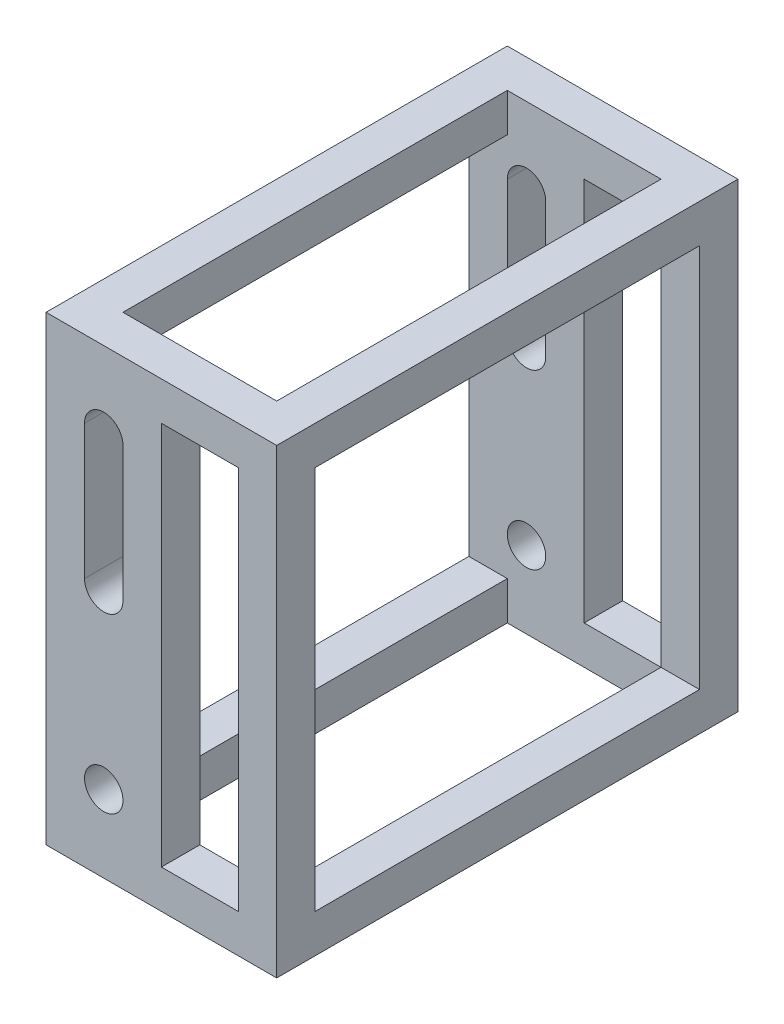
SolidWorks part; units mm, degrees
ref_plane "Front Plane" through (0, 0, 0) normal (0, 0, 1) x (1, 0, 0)
ref_plane "Top Plane" through (0, 0, 0) normal (0, 1, 0) x (1, 0, 0)
ref_plane "Right Plane" through (0, 0, 0) normal (1, 0, 0) x (0, 0, -1)
sketch "Sketch2" plane through (0, 0, 0) normal (0, 0, 1) x (1, 0, 0)
  line L1 (0, 0) -> (76.2, 0)
  line L2 (0, 0) -> (0, 152.4)
  line L3 (0, 152.4) -> (76.2, 152.4)
  line L4 (76.2, 0) -> (76.2, 152.4)
  dimension "D1" = 76.2
  dimension "D2" = 152.4
extrude "Boss-Extrude1" add sketch "Sketch2" along normal blind 152.4
sketch "Sketch3" plane through (0, 152.4, 0) normal (0, 1, 0) x (1, 0, 0)
  line L0 (76.2, 0) -> (0, 0) construction
  line L1 (12.7, -12.7) -> (63.5, -12.7)
  line L2 (12.7, -12.7) -> (12.7, -139.7)
  line L3 (12.7, -139.7) -> (63.5, -139.7)
  line L4 (63.5, -12.7) -> (63.5, -139.7)
  line L5 (76.2, -152.4) -> (76.2, 0) construction
  line L6 (76.2, -152.4) -> (0, -152.4) construction
  line L7 (0, -152.4) -> (0, 0) construction
  dimension "D1" = 12.7
  dimension "D2" = 12.7
  dimension "D3" = 12.7
  dimension "D4" = 12.7
extrude "Cut-Extrude1" cut sketch "Sketch3" against normal through all
sketch "Sketch4" plane through (76.2, 0, 0) normal (1, 0, 0) x (0, 0, -1)
  line L0 (-152.4, 152.4) -> (0, 152.4) construction
  line L1 (-139.7, 139.7) -> (-12.7, 139.7)
  line L2 (-139.7, 139.7) -> (-139.7, 12.7)
  line L3 (-139.7, 12.7) -> (-12.7, 12.7)
  line L4 (-12.7, 139.7) -> (-12.7, 12.7)
  line L5 (0, 0) -> (0, 152.4) construction
  line L6 (-152.4, 0) -> (0, 0) construction
  line L7 (-152.4, 0) -> (-152.4, 152.4) construction
  dimension "D1" = 12.7
  dimension "D2" = 12.7
  dimension "D3" = 12.7
  dimension "D4" = 12.7
extrude "Cut-Extrude2" cut sketch "Sketch4" against normal through all
sketch "Sketch5" plane through (0, 0, 152.4) normal (0, 0, 1) x (1, 0, 0)
  line L0 (76.2, 152.4) -> (0, 152.4) construction
  line L1 (0, 0) -> (76.2, 0) construction
  line L3 (0, 152.4) -> (0, 0) construction
  line L4 (12.7, 127) -> (12.7, 82.55)
  line L5 (25.4, 127) -> (25.4, 82.55)
  arc A0 (25.4, 127) -> (12.7, 127) centre (19.05, 127) ccw
  arc A1 (12.7, 82.55) -> (25.4, 82.55) centre (19.05, 82.55) ccw
  circle A2 centre (19.05, 25.4) radius 6.35
  dimension "D1" = 12.7
  dimension "D2" = 25.4
  dimension "D3" = 44.45
  dimension "D4" = 25.4
  dimension "D5" = 19.05
extrude "Cut-Extrude3" cut sketch "Sketch5" against normal through all
sketch "Sketch6" plane through (0, 0, 152.4) normal (0, 0, 1) x (1, 0, 0)
  line L0 (25.4, 82.55) -> (25.4, 127) construction
  line L1 (38.1, 139.7) -> (63.5, 139.7)
  line L2 (38.1, 139.7) -> (38.1, 12.7)
  line L3 (38.1, 12.7) -> (63.5, 12.7)
  line L4 (63.5, 139.7) -> (63.5, 12.7)
  line L5 (76.2, 152.4) -> (0, 152.4) construction
  line L6 (0, 0) -> (76.2, 0) construction
  line L7 (76.2, 0) -> (76.2, 152.4) construction
  dimension "D1" = 12.7
  dimension "D2" = 12.7
  dimension "D3" = 12.7
  dimension "D4" = 12.7
extrude "Cut-Extrude4" cut sketch "Sketch6" against normal through all
